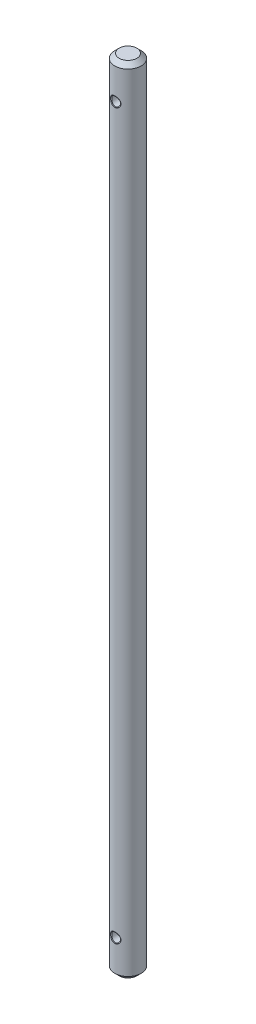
SolidWorks part; units mm, degrees
ref_plane "Plan de face" through (0, 0, 0) normal (0, 0, 1) x (1, 0, 0)
ref_plane "Plan de dessus" through (0, 0, 0) normal (0, 1, 0) x (1, 0, 0)
ref_plane "Plan de droite" through (0, 0, 0) normal (1, 0, 0) x (0, 0, -1)
sketch "Esquisse1" plane through (0, 0, 0) normal (0, 0, 1) x (1, 0, 0)
  line L0 (0, 0) -> (-1, 0)
  line L1 (-1.5, 0.5) -> (-1.5, 89.5)
  line L2 (-1, 90) -> (0, 90)
  line L3 (0, 90) -> (0, 0) construction
  line L4 (-1.5, 89.5) -> (-1, 90)
  line L5 (-1, 0) -> (-1.5, 0.5)
  line L6 (0, 0) -> (0, 90)
  point P1 (-1.5, 0)
  point P4 (-1.5, 90)
  dimension "D1" = 0.5
  dimension "D2" = 45
  dimension "D3" = 45
revolve "Révolution1" add sketch "Esquisse1" angle 360 about L3
sketch "Esquisse2" plane through (0, 0, 0) normal (0, 0, 1) x (1, 0, 0)
  line L0 (0, 63.55) -> (0, 53.4065) construction
  line L1 (1, 90) -> (-1, 90) construction
  circle A0 centre (0, 86) radius 0.5
  dimension "D1" = 1
  dimension "D2" = 4
extrude "Enlèv. mat.-Extru.1" cut sketch "Esquisse2" against normal mid plane 10
chamfer "Chanfrein1" distance 0.1 angle 45 2 edges at (-0.4926, 86.0854, -1.4168) (-0.4926, 85.9146, 1.4168)
sketch "Esquisse3" plane through (0, 0, 0) normal (0, 0, 1) x (1, 0, 0)
  line L0 (0, -1.1429) -> (0, 20.429) construction
  circle A0 centre (0, 4) radius 0.5
  dimension "D1" = 1
  dimension "D2" = 4
extrude "Enlèv. mat.-Extru.2" cut sketch "Esquisse3" against normal mid plane 10
chamfer "Chanfrein2" distance 0.1 angle 45 2 edges at (-0.4926, 4.0854, -1.4168) (-0.4926, 3.9146, 1.4168)
equation "\"D1@Esquisse1\" = \"D\"/6"
